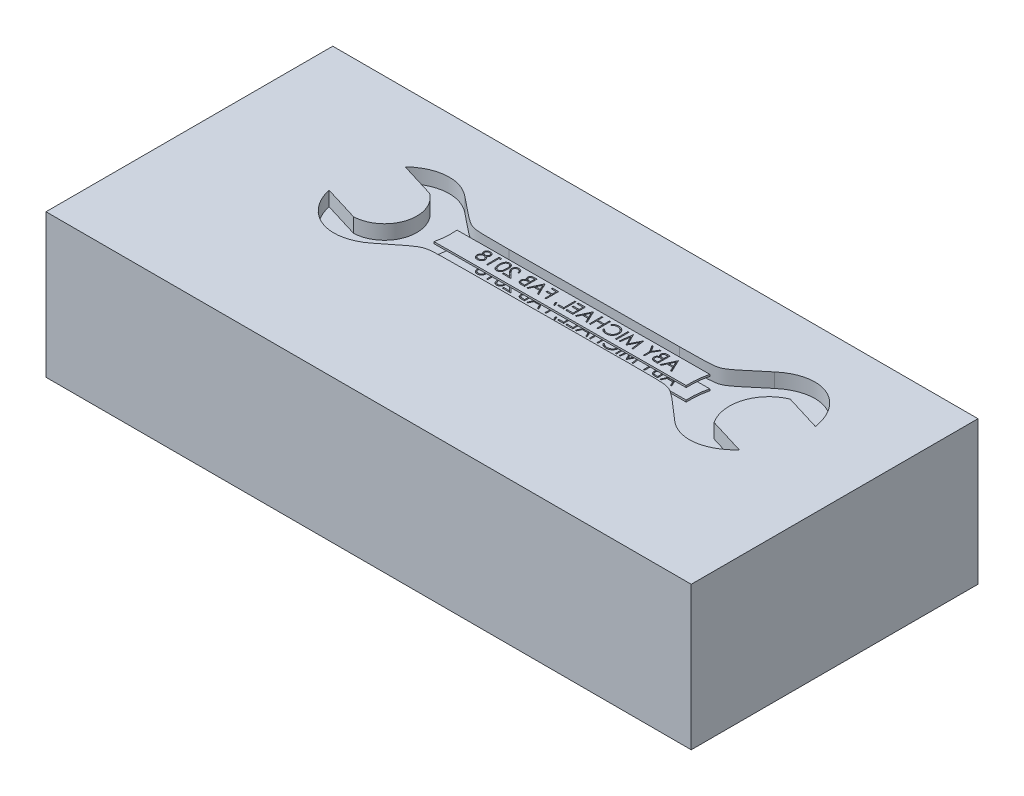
SolidWorks part; units mm, degrees
ref_plane "Front Plane" through (0, 0, 0) normal (0, 0, 1) x (1, 0, 0)
ref_plane "Top Plane" through (0, 0, 0) normal (0, 1, 0) x (1, 0, 0)
ref_plane "Right Plane" through (0, 0, 0) normal (1, 0, 0) x (0, 0, -1)
imported_body "subract-1-solid1"
imported_body "sp-1-solid1"
combine bodies "Combine1" operation type subtract main body 101 bodies to subtract 102
